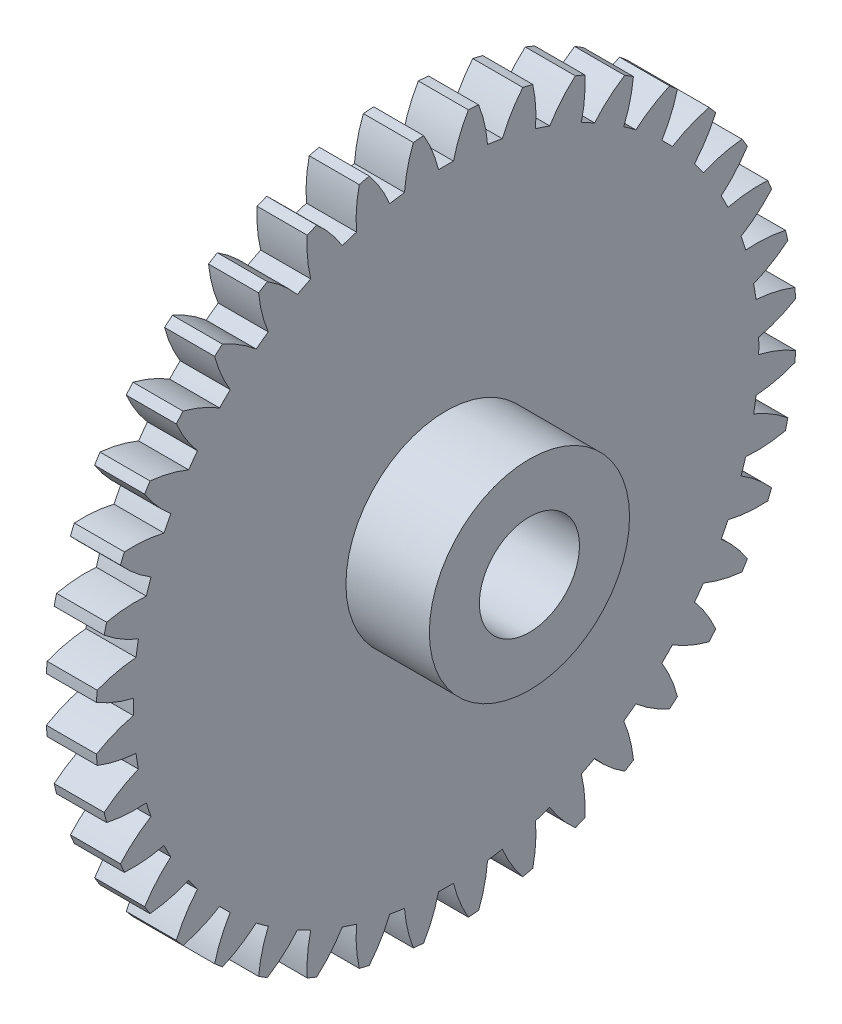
SolidWorks part; units mm, degrees
ref_plane "Plane1" through (0, 0, 0) normal (0, 0, 1) x (1, 0, 0)
ref_plane "Plane2" through (0, 0, 0) normal (0, 1, 0) x (1, 0, 0)
ref_plane "Plane3" through (0, 0, 0) normal (1, 0, 0) x (0, 0, -1)
sketch "HoldingSke" plane through (0, 0, 0) normal (0, 1, 0) x (1, 0, 0)
  line L0 (0, 0) -> (1.5321, -1.2856)
  line L1 (-15, 0) -> (100, 0) construction
  line L2 (0, 0) -> (-2.1039, 2.3779)
  line L3 (0, 0) -> (-11.863, 4.5341)
  line L4 (0, 0) -> (6.6156, 5.5511)
  line L5 (0, 0) -> (-46.8476, -17.4728)
  line L6 (0, 0) -> (-1.2434, -0.839)
  line L7 (-2.1039, 2.3779) -> (8.6586, 51.2059)
  line L8 (-76.2, 54.61) -> (-75.7, 54.61)
  line L9 (-71.009, 38.7566) -> (-53.1078, 45.2721)
  line L10 (-76.2, 71.12) -> (104.1128, 71.12)
  line L11 (0, 0) -> (-1.5, 0)
  line L12 (-76.2, 101.6) -> (-76.181, 101.6)
  line L13 (24.9733, 27.94) -> (52.9518, 28.4284)
  line L14 (24.9733, 27.94) -> (24.9743, 27.94)
  line L15 (24.9733, 27.94) -> (100.4006, 29.5858)
  line L16 (-63.627, -0.5) -> (-12.827, -0.5)
  circle A0 centre (0, 0) radius 1.5
  circle A1 centre (0, 0) radius 9.374
  circle A2 centre (0, 0) radius 37.5
  circle A3 centre (0, 0) radius 1.5
  dimension "MHD" = 18.748
  dimension "Hub_dia" = 75
  dimension "Bore" = 3
  dimension "MBD" = 3
  dimension "Num_teeth" = 40
  dimension "Pitch_radius" = 180.3128
  dimension "Pitch" = 2
  dimension "Width" = 1.5
  dimension "Overall_len" = 50
  dimension "Show_teeth" = 40
  dimension "Thickness" = 1.5
  dimension "OAL" = 50.0001
  dimension "T_dim" = 0.5
  dimension "Ap" = 20
  dimension "H" = 19.05
  dimension "Backlash" = 0.019
  dimension "Addendum_fac" = 1
  dimension "Dedendum_fac" = 1.25
  dimension "Clearance_fac" = 0.25
  dimension "Dedendum_add" = 0.001
  dimension "Module" = 0.5
sketch "BasProSke" plane through (0, 0, 0) normal (0, 1, 0) x (1, 0, 0)
  line L0 (-10, 0) -> (60, 0) construction
  line L1 (0, 0) -> (0, 10.5)
  line L2 (0, 0) -> (1.5, 0)
  line L3 (1.5, 0) -> (1.5, 10.5)
  line L4 (1.5, 10.5) -> (0, 10.5)
  dimension "Diameter" = 21
  dimension "Thickness" = 1.5
revolve "Base-Revolve" add sketch "BasProSke" angle 360 about L0
sketch "TooCutSke" plane through (0, 0, 0) normal (1, 0, 0) x (0, 0, -1)
  line L1 (0, 0) -> (0, 107) construction
  line L2 (0, 0) -> (-0.4258, 9.9909) construction
  line L3 (0, 0) -> (-1.5682, 19.9255) construction
  line L4 (-0.4258, 9.9909) -> (-0.7841, 9.9627) construction
  arc A0 (0.2242, 9.3713) -> (-0.2242, 9.3713) centre (0, 0) ccw
  arc A1 (0.6847, 10.5031) -> (-0.6847, 10.5031) centre (0, 0) ccw
  circle A2 centre (0, 0) radius 10 construction
  circle A3 centre (0, 0) radius 9.3969 construction
  arc A4 (-0.2242, 9.3713) -> (-0.6847, 10.5031) centre (-4.1161, 8.4475) ccw
  arc A5 (0.6847, 10.5031) -> (0.2242, 9.3713) centre (4.1161, 8.4475) ccw
  dimension "Root_dia" = 18.748
  dimension "Overcut_dia" = 21.0508
  dimension "Pitch_dia" = 20
  dimension "Base_dia" = 18.7939
  dimension "Flank_rad" = 4
  dimension "Half_ang" = 4.5
  dimension "Half_CT" = 0.3593
extrude "ToothCut" cut sketch "TooCutSke" along normal through all
fillet "Breaks" radius 0.01
fillet "RootFillets" radius 0.126
pattern_circular "TeethCuts" count 40 every 9 about axis through (-10, 0, 0) along (1, 0, 0) of "ToothCut", "RootFillets", "Breaks"
sketch "HubNeaOneSke" plane through (0, 0, 0) normal (-1, 0, 0) x (0, 0, 1)
  circle A0 centre (0, 0) radius 9.374
  dimension "Diameter" = 18.748
extrude "HubNearOne" add sketch "HubNeaOneSke" along normal blind 48.5001
sketch "HubNeaBotSke" plane through (0, 0, 0) normal (-1, 0, 0) x (0, 0, 1)
  circle A0 centre (0, 0) radius 9.374
  dimension "Diameter" = 18.748
extrude "HubNearBoth" add sketch "HubNeaBotSke" along normal blind 24.25
ref_plane "FarPln" through (1.5, 0, 0) normal (1, 0, 0) x (0, 0, -1)
sketch "HubFarSke" plane through (1.5, 0, 0) normal (1, 0, 0) x (0, 0, -1)
  circle A0 centre (0, 0) radius 9.374
  dimension "Diameter" = 18.748
extrude "HubFar" add sketch "HubFarSke" along normal blind 24.25
sketch "BorSke" plane through (0, 0, 0) normal (1, 0, 0) x (0, 0, -1)
  circle A0 centre (0, 0) radius 1.5
  dimension "Diameter" = 3
extrude "Bore" cut sketch "BorSke" along normal mid plane 100.0001
sketch "KeySke" plane through (0, 0, 0) normal (1, 0, 0) x (0, 0, -1)
  line L0 (-0.6, 0) -> (-0.6, 2)
  line L1 (-0.6, 2) -> (0.6, 2)
  line L2 (0.6, 2) -> (0.6, 0)
  line L3 (0, 0) -> (0, 34) construction
  line L4 (-0.6, 0) -> (0.6, 0)
  dimension "Offset" = 2
  dimension "Width" = 1.2
extrude "Keyway" cut sketch "KeySke" along normal mid plane 100.0001
pattern_circular "Keyway2" count 2 every 90 about axis through (-10, 0, 0) along (1, 0, 0)
sketch "Esquisse1" plane through (1.5, 0, 0) normal (1, 0, 0) x (0, 0, -1)
  circle A0 centre (0, 0) radius 3
  dimension "D1" = 6
extrude "Extrusion1" add sketch "Esquisse1" along normal blind 2.5 and the other way blind 2
sketch "Esquisse2" plane through (4, 0, 0) normal (1, 0, 0) x (0, 0, -1)
  circle A0 centre (0, 0) radius 1.5
  dimension "D1" = 3
extrude "Enlèv. mat.-Extru.1" cut sketch "Esquisse2" against normal through all
sketch "Esquisse4" plane through (0, 0, 0) normal (-1, 0, 0) x (0, 0, 1)
  circle A0 centre (0, 5.5) radius 1.5
  circle A10 centre (0, 0) radius 3 construction
  circle A11 centre (4.7631, 2.75) radius 1.5
  circle A12 centre (4.7631, -2.75) radius 1.5
  circle A13 centre (0, -5.5) radius 1.5
  circle A14 centre (-4.7631, -2.75) radius 1.5
  circle A15 centre (-4.7631, 2.75) radius 1.5
  dimension "D1" = 3
  dimension "D2" = 5.5
extrude "Enlèv. mat.-Extru.3" cut sketch "Esquisse4" against normal blind 0.5
equation "' \"Module@HoldingSke\" = 6.35"
equation "' \"Num_teeth@HoldingSke\" = 12"
equation "' \"Ap@HoldingSke\" =  20"
equation "' \"Width@HoldingSke\" = 0.5 * 25.4"
equation "' \"Hub_dia@HoldingSke\"= 1 * 25.4"
equation "' \"Overall_len@HoldingSke\" = 1.0 * 25.4"
equation "' \"Bore@HoldingSke\" = 0.75 * 25.4"
equation "' \"T_dim@HoldingSke\" = 0.1 * 25.4"
equation "' \"Width@KeySke\" = 0.25 * 25.4"
equation "' \"Show_teeth@HoldingSke\" = 13"
equation "' \"Backlash@HoldingSke\" = 0.009 * 25.4"
equation "' \"Addendum_fac@HoldingSke\" = 1.0"
equation "' \"Dedendum_fac@HoldingSke\" = 1.25"
equation "' \"Dedendum_add@HoldingSke\" = 0.00005 * 25.4"
equation "' \"Clearance_fac@HoldingSke\" = 0.25"
equation "\"Pitch@HoldingSke\" = 1 / \"Module@HoldingSke\""
equation "\"Overcut_dia@TooCutSke\" = (\"Num_teeth@HoldingSke\" + 2 * \"Addendum_fac@HoldingSke\") / \"Pitch@HoldingSke\" + 0.002 * 25.4"
equation "\"Pitch_dia@TooCutSke\" = \"Num_teeth@HoldingSke\" / \"Pitch@HoldingSke\""
equation "\"Base_dia@TooCutSke\" = \"Num_teeth@HoldingSke\" / \"Pitch@HoldingSke\" * cos((\"Ap@HoldingSke\"  * 3.14159265 / 180))"
equation "\"Root_dia@TooCutSke\" = (\"Num_teeth@HoldingSke\" + 2) / \"Pitch@HoldingSke\" - 2 * (\"Addendum_fac@HoldingSke\" + \"Dedendum_fac@HoldingSke\") / \"Pitch@HoldingSke\" - \"Dedendum_add@HoldingSke\" * 2"
equation "\"Half_ang@TooCutSke\" = 180 / \"Num_teeth@HoldingSke\""
equation "\"Half_CT@TooCutSke\" = \"Num_teeth@HoldingSke\" / \"Pitch@HoldingSke\" * sin((3.14159265 / 2 / \"Num_teeth@HoldingSke\")) / 2 - 7 * \"Backlash@HoldingSke\" / 4"
equation "\"Flank_rad@TooCutSke\" = \"Num_teeth@HoldingSke\" / \"Pitch@HoldingSke\" / 5"
equation "\"Radius@RootFillets\" = \"Clearance_fac@HoldingSke\" / \"Pitch@HoldingSke\" + \"Dedendum_add@HoldingSke\""
equation "\"Break_rad@Breaks\" = 0.02 / \"Pitch@HoldingSke\""
equation "\"Thickness@HoldingSke\" = \"Width@HoldingSke\""
equation "\"OAL@HoldingSke\" = \"Thickness@HoldingSke\""
equation "\"MHD@HoldingSke\" = (\"Num_teeth@HoldingSke\" + 2) / \"Pitch@HoldingSke\" - 2 * (\"Addendum_fac@HoldingSke\" + \"Dedendum_fac@HoldingSke\")  / \"Pitch@HoldingSke\" - \"Dedendum_add@HoldingSke\" * 2"
equation "\"MBD@HoldingSke\" = (\"Num_teeth@HoldingSke\" + 2) / \"Pitch@HoldingSke\" - 2 * (\"Addendum_fac@HoldingSke\" + \"Dedendum_fac@HoldingSke\")  / \"Pitch@HoldingSke\" - \"Dedendum_add@HoldingSke\" * 2 - 0.002 * 25.4"
equation "\"MHD@HoldingSke\" = ((sgn( \"MHD@HoldingSke\" - \"Hub_dia@HoldingSke\" )-1)*( \"MHD@HoldingSke\" - \"Hub_dia@HoldingSke\" ))/-2+ \"Hub_dia@HoldingSke\""
equation "\"MBD@HoldingSke\" = ((sgn( \"MBD@HoldingSke\" - \"Bore@HoldingSke\" )-1)*( \"MBD@HoldingSke\" - \"Bore@HoldingSke\" ))/-2+ \"Bore@HoldingSke\""
equation "\"OAL@HoldingSke\" = ((sgn( \"OAL@HoldingSke\" - \"Overall_len@HoldingSke\" )+1)*( \"OAL@HoldingSke\" - \"Overall_len@HoldingSke\" ))/2 + \"Overall_len@HoldingSke\" + 0.000002 * 25.4"
equation "\"Num_teeth@TeethCuts\" = int( \"Show_teeth@HoldingSke\" ) + 1"
equation "\"Num_teeth@TeethCuts\" = ((sgn( \"Num_teeth@TeethCuts\" - \"Num_teeth@HoldingSke\" )-1)*( \"Num_teeth@TeethCuts\" - \"Num_teeth@HoldingSke\" ))/-2+ \"Num_teeth@HoldingSke\""
equation "\"Num_teeth@TeethCuts\" = ((sgn( \"Num_teeth@TeethCuts\" - 2.0)+1)*( \"Num_teeth@TeethCuts\" - 2.0))/2 +2.0"
equation "\"Angle@TeethCuts\" = 360.0 / \"Num_teeth@HoldingSke\""
equation "\"Diameter@BasProSke\" = (\"Num_teeth@HoldingSke\" + 2 * \"Addendum_fac@HoldingSke\") / \"Pitch@HoldingSke\""
equation "\"Thickness@BasProSke\"  = \"Thickness@HoldingSke\""
equation "' \"Fillet_rad@BasProSke\" =  \"Thickness@HoldingSke\" * 0.05"
equation "\"MHD@HoldingSke\" = ((sgn( \"MHD@HoldingSke\" - \"Root_dia@TooCutSke\" )-1)*( \"MHD@HoldingSke\" - \"Root_dia@TooCutSke\" ))/-2+ \"Root_dia@TooCutSke\""
equation "\"Diameter@HubNeaOneSke\" = \"MHD@HoldingSke\""
equation "\"Length@HubNearOne\" = \"OAL@HoldingSke\" - \"Thickness@BasProSke\""
equation "\"Diameter@HubNeaBotSke\" = \"MHD@HoldingSke\""
equation "\"Length@HubNearBoth\" = ( \"OAL@HoldingSke\" - \"Thickness@BasProSke\" ) / 2.0"
equation "\"Thickness@FarPln\" = \"Thickness@BasProSke\""
equation "\"Diameter@HubFarSke\" = \"MHD@HoldingSke\""
equation "\"Length@HubFar\" = ( \"OAL@HoldingSke\" - \"Thickness@BasProSke\" ) / 2.0"
equation "\"Diameter@BorSke\" = \"MBD@HoldingSke\""
equation "\"D1@Bore\" = \"OAL@HoldingSke\" * 2.0"
equation "\"D1@Keyway\" = \"OAL@HoldingSke\" * 2.0"
equation "\"Offset@KeySke\" = \"T_dim@HoldingSke\" + \"MBD@HoldingSke\" / 2.0"
